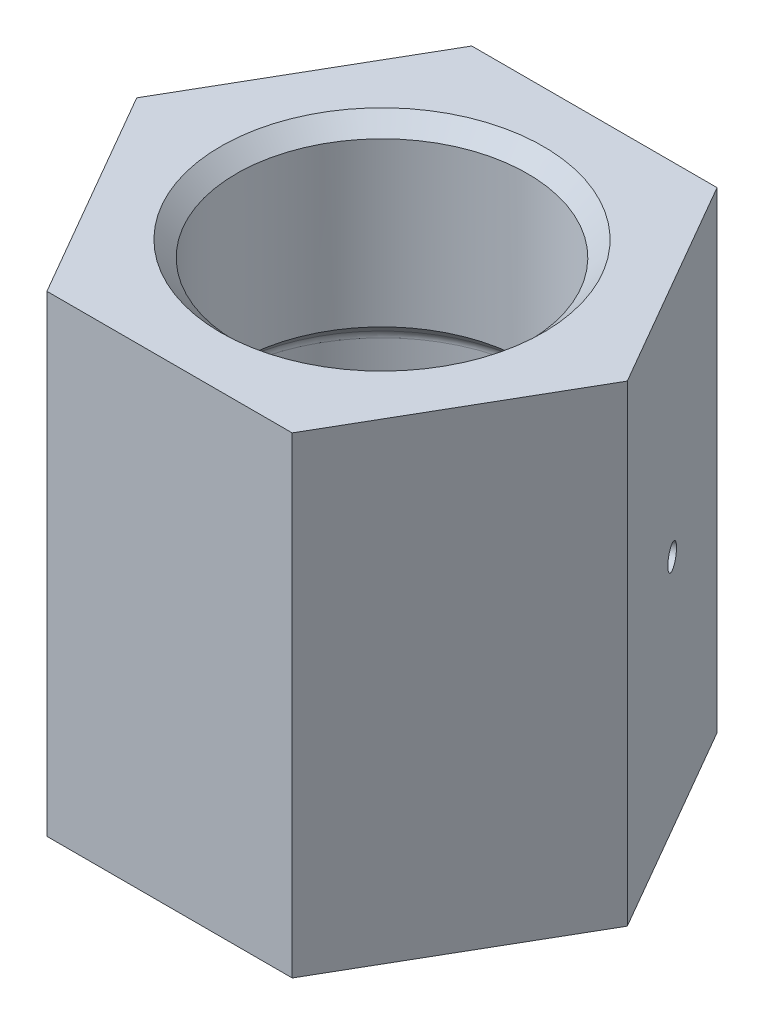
SolidWorks part; units mm, degrees
ref_plane "Přední rovina" through (0, 0, 0) normal (0, 0, 1) x (1, 0, 0)
ref_plane "Horní rovina" through (0, 0, 0) normal (0, 1, 0) x (1, 0, 0)
ref_plane "Pravá rovina" through (0, 0, 0) normal (1, 0, 0) x (0, 0, -1)
sketch "Skica1" plane through (0, 0, 0) normal (0, 1, 0) x (1, 0, 0)
  line L1 (15.5885, 0) -> (7.7942, 13.5)
  line L2 (7.7942, 13.5) -> (-7.7942, 13.5)
  line L3 (-7.7942, 13.5) -> (-15.5885, 0)
  line L4 (-15.5885, 0) -> (-7.7942, -13.5)
  line L5 (-7.7942, -13.5) -> (7.7942, -13.5)
  line L6 (7.7942, -13.5) -> (15.5885, 0)
  circle A0 centre (0, 0) radius 13.5 construction
extrude "Přidat vysunutím1" add sketch "Skica1" along normal blind 30
hole_wizard "M20x1.5 závit1" positions "Skica3" profile "Skica2" tap size "M20x1.5" standard "ISO"
sketch "Skica3" plane through (0, 30, 0) normal (0, 1, 0) x (-1, 0, 0)
  line L0 (-7.7942, -13.5) -> (7.7942, -13.5) construction
  line L1 (-15.5885, 0) -> (-7.7942, -13.5) construction
  point P0 (0, 0)
  point P6 (-11.6913, -6.75)
  dimension "D1" = 13.5
  dimension "D2" = 13.5
sketch "Skica2" plane through (0, 30, 0) normal (1, 0, 0) x (0, 0, 1)
  line L0 (0, 0) -> (0, 53.058)
  line L1 (0, 53.058) -> (9.25, 47.5)
  line L2 (9.25, 47.5) -> (9.25, 0)
  line L5 (9.25, 0) -> (0, 0)
  line L10 (0, 53.058) -> (-9.25, 47.5) construction
  line L11 (0, -6.35) -> (0, 107.95) construction
  dimension "Průměr závitníku" = 18.5
  dimension "Hloubka závitníku" = 47.5
  dimension "Úhel vrtání" = 118
chamfer "Zkosení1" distance 1 angle 45 2 edges at (0, 0, 9.25) (0, 30, 9.25)
sketch "Skica4" plane through (0, 0, 0) normal (0, 0, 1) x (1, 0, 0)
  line L0 (-9.25, 12.6496) -> (-10.25, 13.6496)
  line L1 (-10.25, 13.6496) -> (-10.25, 17.6496)
  line L2 (-10.25, 17.6496) -> (-9.25, 18.6496)
  line L5 (0, 0) -> (0, 29.8955) construction
  line L6 (-9.25, 12.6496) -> (-9.25, 18.6496)
  dimension "D1" = 9.25
  dimension "D2" = 1
  dimension "D3" = 1
  dimension "D4" = 1
  dimension "D5" = 4
revolve "Odebrat rotací1" cut sketch "Skica4" angle 360 about L5
fillet "Zaoblit1" radius 0.75 2 edges at (0, 13.6496, -10.25) (0, 17.6496, -10.25)
sketch "Skica5" plane through (11.6913, 0, -6.75) normal (0.866, 0, -0.5) x (-0.5, 0, -0.866)
  line L0 (-7.7942, 0) -> (7.7942, 0) construction
  circle A0 centre (0, 15) radius 0.75
  point P2 (0, 0)
  dimension "D1" = 15
extrude "Odebrat vysunutím1" cut sketch "Skica5" against normal up to surface (3.2775 mm away)
